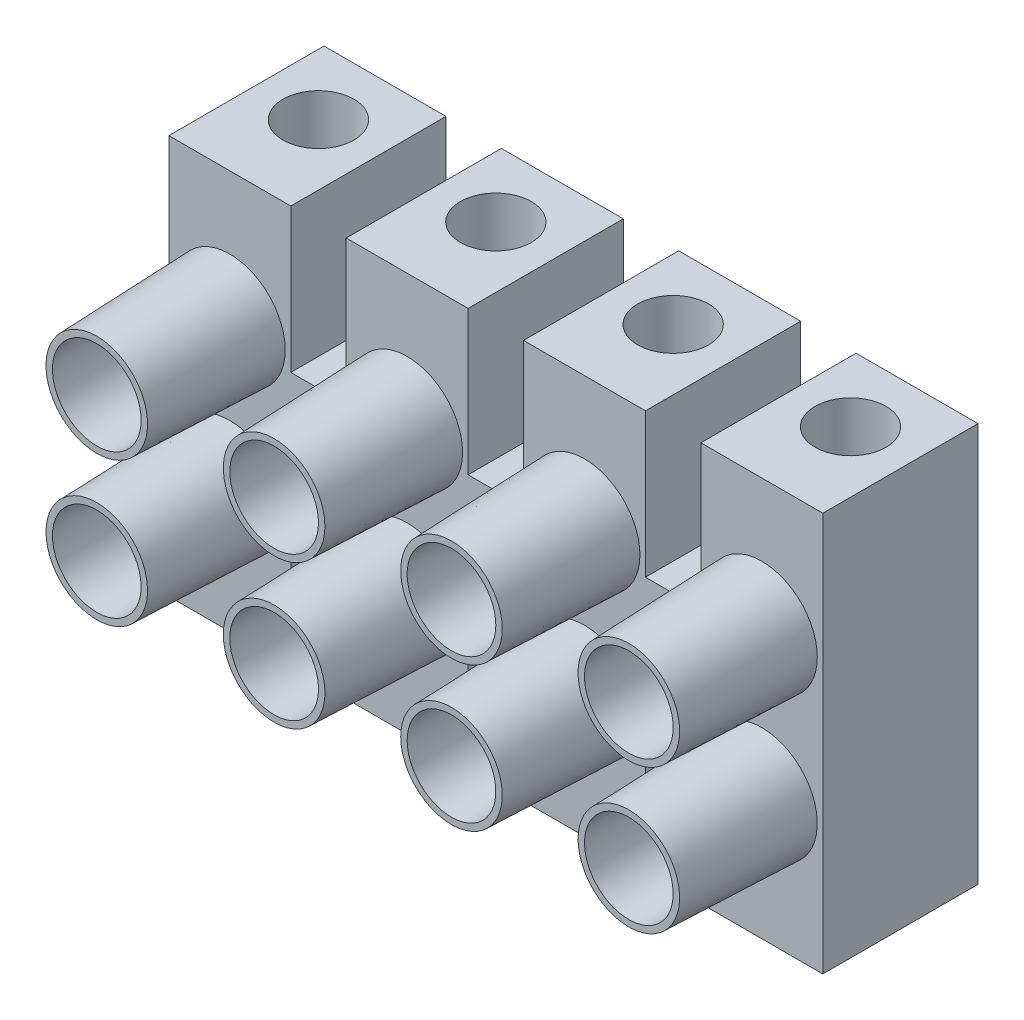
SolidWorks part; units mm, degrees
ref_plane "Face" through (0, 0, 0) normal (0, 0, 1) x (1, 0, 0)
ref_plane "Dessus" through (0, 0, 0) normal (0, 1, 0) x (1, 0, 0)
ref_plane "Droite" through (0, 0, 0) normal (1, 0, 0) x (0, 0, -1)
sketch "Esquisse1" plane through (0, 0, 0) normal (0, 0, 1) x (1, 0, 0)
  line L0 (-4.9042, 0) -> (59.2709, 0) construction
  line L1 (0, 20.3118) -> (0, -20.4548) construction
  line L2 (5.5, 22.3143) -> (5.5, 1.1443) construction
  line L3 (8, 16.8788) -> (8, 1.1443) construction
  line L4 (-3.3916, 9) -> (17.4208, 9) construction
  line L5 (-1.7466, 2.5) -> (11.2701, 2.5) construction
  line L6 (0, 2.5) -> (0, 9)
  line L7 (0, 9) -> (5.5, 9)
  line L8 (5.5, 9) -> (5.5, 2.5)
  line L9 (5.5, 2.5) -> (8, 2.5)
  line L10 (13.5, 2.5) -> (16, 2.5)
  line L11 (13.5, 9) -> (13.5, 2.5)
  line L12 (8, 9) -> (13.5, 9)
  line L13 (8, 2.5) -> (8, 9)
  line L14 (21.5, 2.5) -> (24, 2.5)
  line L15 (21.5, 9) -> (21.5, 2.5)
  line L16 (16, 9) -> (21.5, 9)
  line L17 (16, 2.5) -> (16, 9)
  line L20 (24, 9) -> (29.5, 9)
  line L21 (24, 2.5) -> (24, 9)
  line L26 (37.5, 2.5) -> (40, 2.5)
  line L27 (0, 2.5) -> (0, -2.5)
  line L31 (24, -2.5) -> (24, -9)
  line L32 (24, -9) -> (29.5, -9)
  line L33 (29.5, -9) -> (29.5, 9)
  line L35 (16, -2.5) -> (16, -9)
  line L36 (16, -9) -> (21.5, -9)
  line L37 (21.5, -9) -> (21.5, -2.5)
  line L38 (21.5, -2.5) -> (24, -2.5)
  line L39 (8, -2.5) -> (8, -9)
  line L40 (8, -9) -> (13.5, -9)
  line L41 (13.5, -9) -> (13.5, -2.5)
  line L42 (13.5, -2.5) -> (16, -2.5)
  line L43 (5.5, -2.5) -> (8, -2.5)
  line L44 (5.5, -9) -> (5.5, -2.5)
  line L45 (0, -9) -> (5.5, -9)
  line L46 (0, -2.5) -> (0, -9)
  line L61 (37.5, 9) -> (37.5, 2.5)
  line L62 (32, 9) -> (37.5, 9)
  line L63 (32, 2.5) -> (32, 9)
  line L64 (29.5, 2.5) -> (32, 2.5)
  line L65 (29.5, 9) -> (29.5, 2.5)
  circle A0 centre (6.75, 0) radius 1.6
  circle A1 centre (14.75, 0) radius 1.6
  circle A2 centre (22.75, 0) radius 1.6
  circle A5 centre (30.75, 0) radius 1.6
  point P34 (0, 0)
extrude "Base-Extrusion" add sketch "Esquisse1" along normal blind 7
sketch "Esquisse2" plane through (0, 0, 7) normal (0, 0, 1) x (1, 0, 0)
  line L0 (-1.4565, 0) -> (47.5746, 0) construction
  circle A0 centre (2.75, 3.25) radius 2.5
  circle A1 centre (2.75, 3.25) radius 2
  circle A2 centre (10.75, 3.25) radius 2.5
  circle A3 centre (10.75, 3.25) radius 2
  circle A4 centre (18.75, 3.25) radius 2.5
  circle A5 centre (18.75, 3.25) radius 2
  circle A6 centre (26.75, 3.25) radius 2.5
  circle A7 centre (26.75, 3.25) radius 2
  circle A12 centre (26.75, -3.25) radius 2
  circle A13 centre (26.75, -3.25) radius 2.5
  circle A14 centre (18.75, -3.25) radius 2
  circle A15 centre (18.75, -3.25) radius 2.5
  circle A16 centre (10.75, -3.25) radius 2
  circle A17 centre (10.75, -3.25) radius 2.5
  circle A18 centre (2.75, -3.25) radius 2
  circle A19 centre (2.75, -3.25) radius 2.5
  circle A24 centre (34.75, 3.25) radius 2.5
  circle A25 centre (34.75, 3.25) radius 2
extrude "Boss.-Extru.1" add sketch "Esquisse2" along normal blind 6
sketch "Esquisse3" plane through (0, -9, 0) normal (0, -1, 0) x (1, 0, 0)
  circle A0 centre (2.75, 3) radius 1.6
  circle A1 centre (10.75, 3) radius 1.6
  circle A2 centre (18.75, 3) radius 1.6
  circle A3 centre (26.75, 3) radius 1.6
  circle A6 centre (34.75, 3) radius 1.6
draft "Dépouille1" type of draft neutral plane draft angle 2 faces to draft 8 parameters "D1"=2
extrude "Enlèv. mat.-Extru.1" cut sketch "Esquisse3" against normal through all
